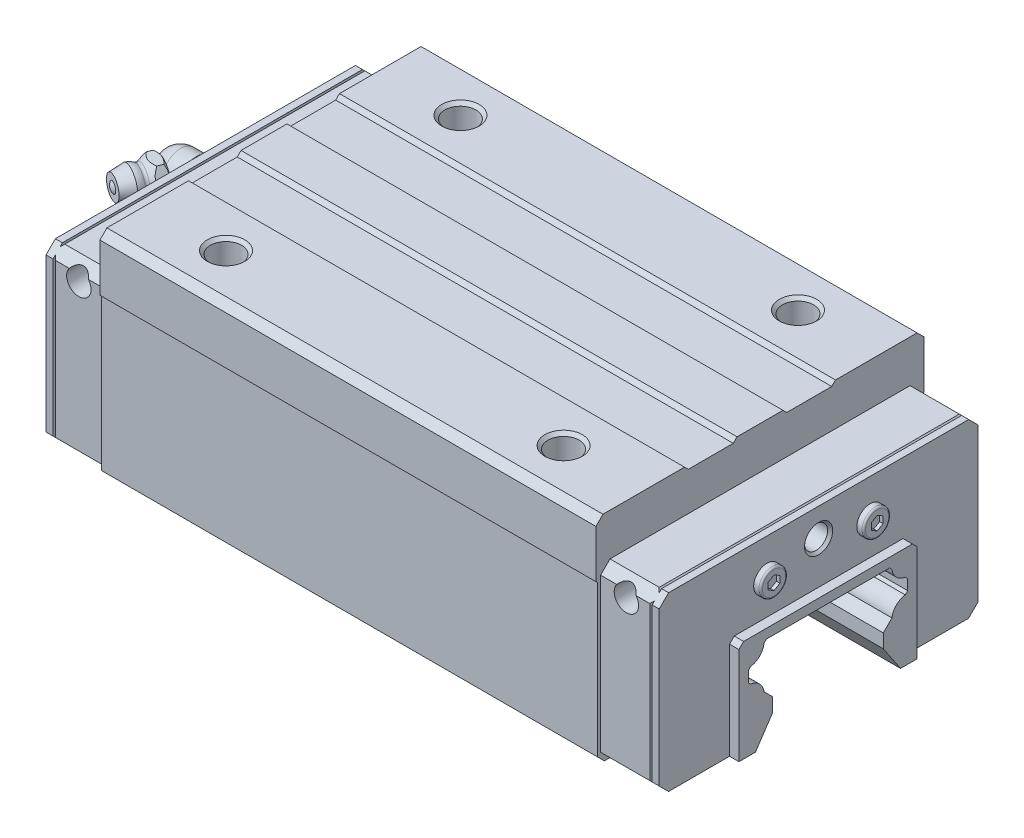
SolidWorks part; units mm, degrees
ref_plane "Front Plane" through (0, 0, 0) normal (0, 0, 1) x (1, 0, 0)
ref_plane "Top Plane" through (0, 0, 0) normal (0, 1, 0) x (1, 0, 0)
ref_plane "Right Plane" through (0, 0, 0) normal (1, 0, 0) x (0, 0, -1)
imported_body "HSR35LR1SS-280L_G20_0_B-M6F_72-6_0_0_0_1(R2).stp-1/_HSR35LRSSB-M6F1 Slider-1-R2.stp-1-solid1"
imported_body "HSR35LR1SS-280L_G20_0_B-M6F_72-6_0_0_0_1(R2).stp-1/_hsr_ftht_B-M6F_grease_nipple_joint.stp-1-solid1"
move or copy body "Body-Move/Copy1" bodies to move or copy 104 103 copy no translate (-120, 0, 0)
